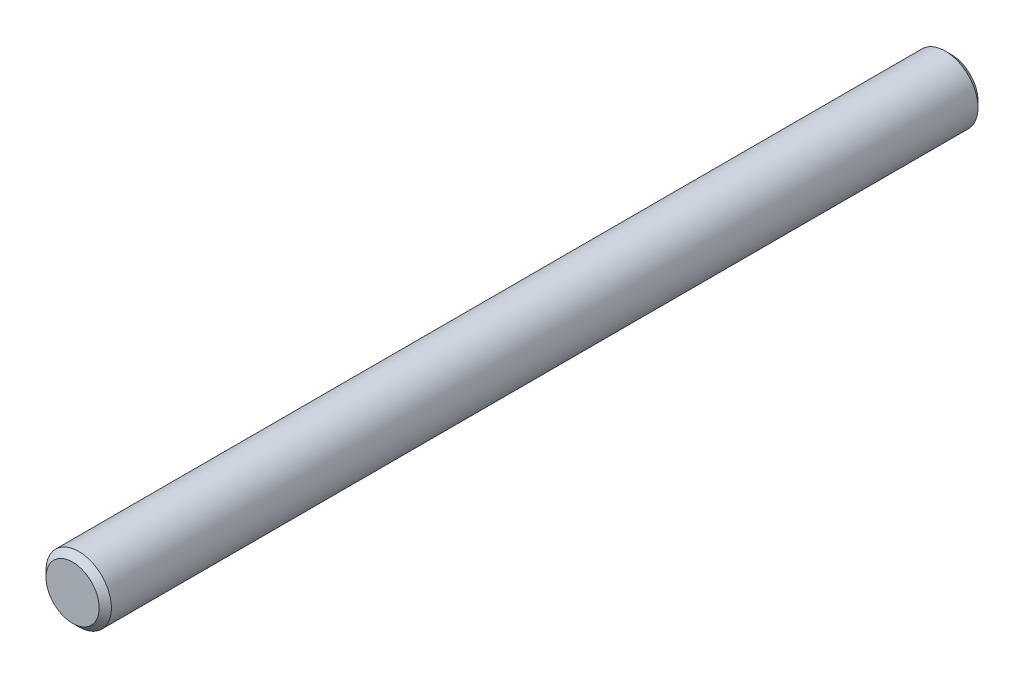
SolidWorks part; units mm, degrees
ref_plane "Plan de face" through (0, 0, 0) normal (0, 0, 1) x (1, 0, 0)
ref_plane "Plan de dessus" through (0, 0, 0) normal (0, 1, 0) x (1, 0, 0)
ref_plane "Plan de droite" through (0, 0, 0) normal (1, 0, 0) x (0, 0, -1)
sketch "Esquisse1" plane through (0, 0, 0) normal (0, 0, 1) x (1, 0, 0)
  circle A0 centre (0, 0) radius 8
  dimension "D1" = 16
extrude "Volume" add sketch "Esquisse1" along normal blind 215
chamfer "Chanfrein1" distance 1.5 angle 45 2 edges at (8, 0, 0) (8, 0, 215)
